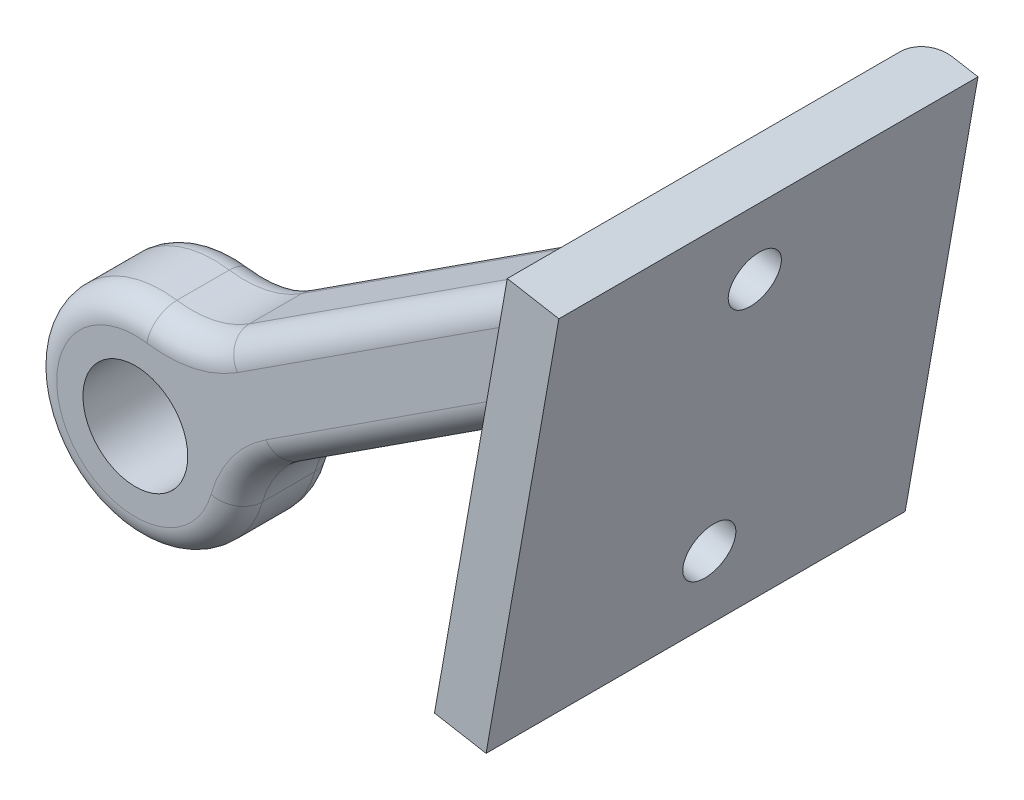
SolidWorks part; units mm, degrees
ref_plane "Front" through (0, 0, 0) normal (0, 0, 1) x (1, 0, 0)
ref_plane "Top" through (0, 0, 0) normal (0, 1, 0) x (1, 0, 0)
ref_plane "Right" through (0, 0, 0) normal (1, 0, 0) x (0, 0, -1)
sketch "Sketch1" plane through (0, 0, 0) normal (0, 0, 1) x (1, 0, 0)
  line L0 (0, 0) -> (25.4, 144.0506) construction
  line L1 (25.4, 144.0506) -> (25.4, 0) construction
  line L2 (25.4, 0) -> (0, 0) construction
  line L3 (4.4107, 25.0141) -> (-1.8429, 26.1168)
  line L4 (-1.8429, 26.1168) -> (6.9785, 76.145)
  line L5 (6.9785, 76.145) -> (13.232, 75.0424)
  line L6 (13.232, 75.0424) -> (4.4107, 25.0141)
  line L7 (-76.2, 0) -> (2.5678, 51.1309) construction
  circle A0 centre (-76.2, 0) radius 12.7
  dimension "D1" = 25.4
  dimension "D2" = 76.2
  dimension "D3" = 50.8
  dimension "D4" = 25.4
  dimension "D5" = 6.35
  dimension "D6" = 10
  dimension "D7" = 25.4
sketch "Sketch2" plane through (0, 0, 0) normal (0, 0, 1) x (1, 0, 0)
  line L0 (-1.8429, 26.1168) -> (6.9785, 76.145) construction
  line L1 (1.0604, 42.5818) -> (4.0752, 59.68)
  line L2 (-56.7711, 12.612) -> (60.7287, 88.8851) construction
  line L3 (-76.2, 0) -> (2.5678, 51.1309) construction
  line L4 (-70.4321, 11.3147) -> (4.0752, 59.68)
  line L5 (-63.5173, 0.6622) -> (1.0604, 42.5818)
  circle A0 centre (-76.2, 0) radius 12.7 construction
  arc A1 (-70.4321, 11.3147) -> (-63.5173, 0.6622) centre (-76.2, 0) ccw
  dimension "D1" = 12.7
extrude "Base-Extrude" add sketch "Sketch2" along normal blind 12.7
sketch "Sketch3" plane through (0, 0, 0) normal (0, 0, 1) x (1, 0, 0)
  line L4 (4.4107, 25.0141) -> (-1.8429, 26.1168)
  line L5 (13.232, 75.0424) -> (4.4107, 25.0141)
  line L6 (6.9785, 76.145) -> (13.232, 75.0424)
  line L7 (-1.8429, 26.1168) -> (6.9785, 76.145)
  line L8 (4.4107, 25.0141) -> (-1.8429, 26.1168)
  line L9 (13.232, 75.0424) -> (4.4107, 25.0141)
  line L10 (6.9785, 76.145) -> (13.232, 75.0424)
  line L11 (-1.8429, 26.1168) -> (6.9785, 76.145)
  dimension "D1" = 0
extrude "Boss-Extrude1" add sketch "Sketch3" along normal blind 50.8
fillet "Fillet1" radius 12.7 2 edges at (-63.5173, 0.6622, 6.35) (-70.4321, 11.3147, 6.35)
sketch "Sketch5" plane through (-6.2535, 1.1027, 0) normal (-0.9848, 0.1736, 0) x (0, 0, 1)
  line L0 (25.4, 76.2) -> (25.4, 25.4) construction
  line L1 (50.8, 76.2) -> (0, 76.2) construction
  line L2 (50.8, 25.4) -> (0, 25.4) construction
  circle A0 centre (25.4, 66.675) radius 3.175
  circle A1 centre (25.4, 34.925) radius 3.175
  dimension "D3" = 6.35
  dimension "D4" = 6.35
  dimension "D1" = 9.525
  dimension "D2" = 9.525
extrude "Cut-Extrude2" cut sketch "Sketch5" against normal through all
fillet "Fillet4" radius 9.525 2 edges at (4.0752, 59.68, 6.35) (1.0604, 42.5818, 6.35)
fillet "Fillet5" radius 3.175 15 edges at (-37.4064, 17.6117, 0) (-37.4064, 17.6117, 12.7) (-86.8524, -6.9149, 0) (-86.8524, -6.9149, 12.7) (-32.4826, 35.9491, 0) (-32.4826, 35.9491, 12.7) (-61.9703, 0.6885, 0) (-61.9703, 0.6885, 12.7) (-69.7784, 12.717, 0) (-69.7784, 12.717, 12.7) (5.8865, 69.9524, 0) (-7.6778, 32.3485, 0) (-7.6778, 32.3485, 12.7) (3.3566, 60.1558, 0) (3.3566, 60.1558, 12.7)
sketch "Sketch6" plane through (0, 0, 12.7) normal (0, 0, 1) x (1, 0, 0)
  circle A0 centre (-76.2, 0) radius 6.35
  dimension "D1" = 12.7
extrude "Cut-Extrude3" cut sketch "Sketch6" against normal through all
fillet "Fillet6" radius 1.5875 4 edges at (1.195, 43.3451, 12.7) (2.8414, 55.1119, 12.7) (3.8228, 58.2485, 12.236) (-1.6488, 27.2176, 11.3088)
